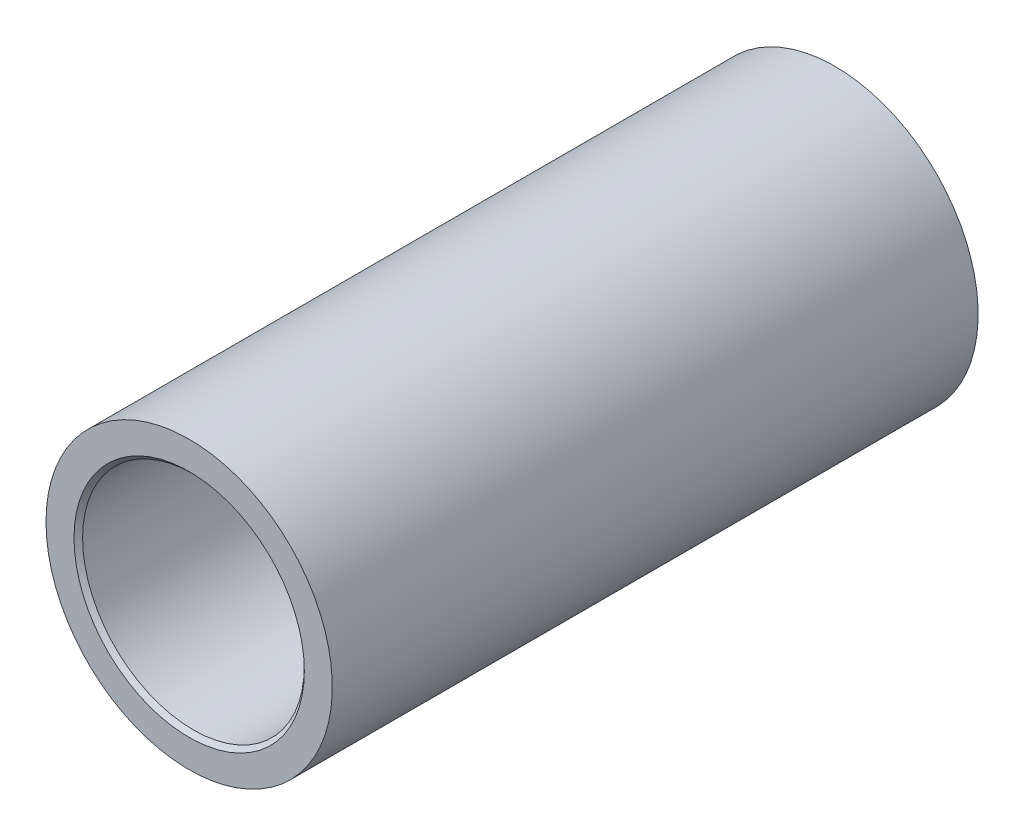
SolidWorks part; units mm, degrees
ref_plane "Front Plane" through (0, 0, 0) normal (0, 0, 1) x (1, 0, 0)
ref_plane "Top Plane" through (0, 0, 0) normal (0, 1, 0) x (1, 0, 0)
ref_plane "Right Plane" through (0, 0, 0) normal (1, 0, 0) x (0, 0, -1)
sketch "Sketch1" plane through (0, 0, 0) normal (0, 0, 1) x (1, 0, 0)
  circle A0 centre (0, 0) radius 6.5405
  circle A1 centre (0, 0) radius 8.4455
  dimension "D1" = 13.081
  dimension "D2" = 16.891
extrude "Boss-Extrude1" add sketch "Sketch1" along normal blind 38.1
chamfer "Chamfer1" distance 0.254 angle 45 2 edges at (6.5405, 0, 0) (6.5405, 0, 38.1)
